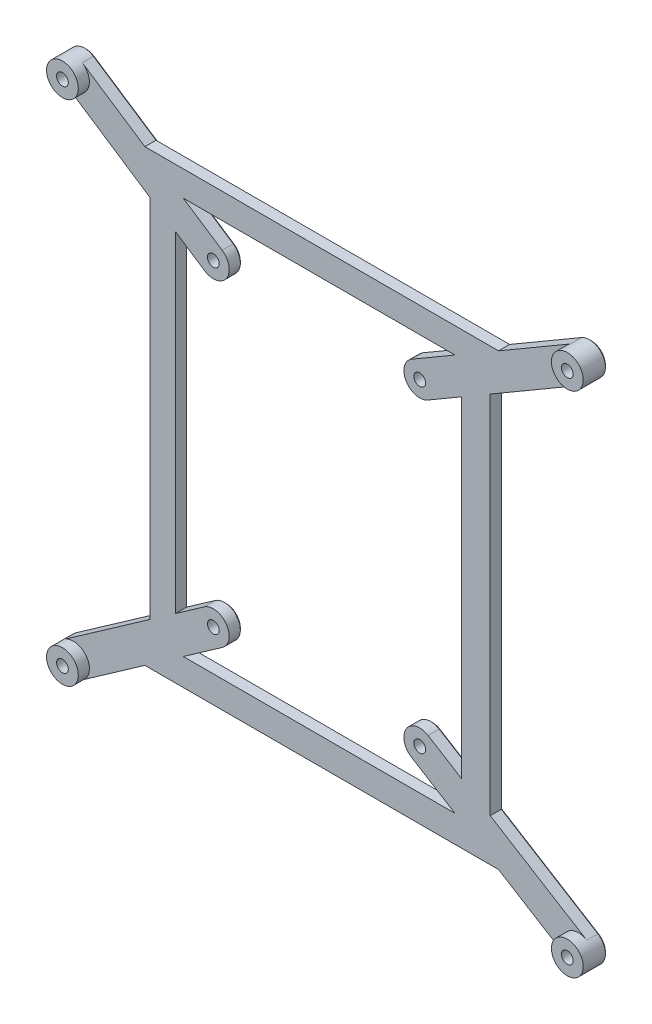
SolidWorks part; units mm, degrees
ref_plane "Ebene vorne" through (0, 0, 0) normal (0, 0, 1) x (1, 0, 0)
ref_plane "Ebene oben" through (0, 0, 0) normal (0, 1, 0) x (1, 0, 0)
ref_plane "Ebene rechts" through (0, 0, 0) normal (1, 0, 0) x (0, 0, -1)
sketch "Skizze1" plane through (0, 0, 0) normal (0, 0, 1) x (1, 0, 0)
  line L5 (82.1313, -75.7293) -> (51.7323, -56.9557)
  line L19 (32.1613, -44.8693) -> (26.8987, -53.3907) construction
  line L20 (-32.6003, -53.2245) -> (-38.3397, -45.0355) construction
  line L25 (-55.347, 58.0292) -> (-55.347, -56.9557)
  line L26 (-32.7105, 55.0396) -> (-38.2295, 46.7004) construction
  line L28 (-38.3397, -45.0355) -> (-47.347, -51.3486)
  line L29 (-76.6303, -84.0845) -> (-57.0231, -70.3421)
  line L31 (26.8987, -53.3907) -> (40.6285, -61.8699)
  line L32 (32.0488, 46.5508) -> (27.0112, 55.1892) construction
  line L33 (27.0112, 55.1892) -> (40.6285, 63.1301)
  line L35 (-76.7405, 84.1796) -> (-57.0231, 71.1301)
  line L36 (-38.2295, 46.7004) -> (-47.347, 52.7346)
  line L38 (82.0188, 75.6908) -> (51.7323, 58.0292)
  line L39 (-47.347, 52.7346) -> (-47.347, -51.3486)
  line L40 (-55.347, 58.0292) -> (-82.2595, 75.8404)
  line L41 (-55.347, -56.9557) -> (-82.3697, -75.8955)
  line L42 (-57.0231, 71.1301) -> (54.3471, 71.1301)
  line L43 (40.6285, 63.1301) -> (-44.9352, 63.1301)
  line L44 (42.653, -51.3486) -> (42.653, 52.7346)
  line L45 (51.7323, 58.0292) -> (51.7323, -56.9557)
  line L46 (-57.0231, -70.3421) -> (54.3471, -70.3421)
  line L47 (40.6285, -61.8699) -> (-44.9352, -61.8699)
  line L48 (-44.9352, -61.8699) -> (-32.6003, -53.2245)
  line L49 (54.3471, -70.3421) -> (76.8687, -84.2507)
  line L50 (42.653, -51.3486) -> (32.1613, -44.8693)
  line L51 (42.653, 52.7346) -> (32.0488, 46.5508)
  line L52 (54.3471, 71.1301) -> (76.9812, 84.3292)
  line L53 (-44.9352, 63.1301) -> (-32.7105, 55.0396)
  line L54 (-47.347, 0.693) -> (42.653, 0.693) construction
  line L55 (-2.1534, 63.1301) -> (-2.1534, -61.8699) construction
  arc A0 (-82.3697, -75.8955) -> (-76.6303, -84.0845) centre (-79.5, -79.99) ccw
  arc A1 (76.8687, -84.2507) -> (82.1313, -75.7293) centre (79.5, -79.99) ccw
  arc A2 (-32.6003, -53.2245) -> (-38.3397, -45.0355) centre (-35.47, -49.13) ccw
  arc A3 (26.8987, -53.3907) -> (32.1613, -44.8693) centre (29.53, -49.13) cw
  circle A4 centre (-35.47, -49.13) radius 1.85
  circle A5 centre (29.53, -49.13) radius 1.85
  circle A6 centre (29.53, 50.87) radius 1.85
  circle A7 centre (-35.47, 50.87) radius 1.85
  arc A8 (76.9812, 84.3292) -> (82.0188, 75.6908) centre (79.5, 80.01) cw
  arc A9 (-82.2595, 75.8404) -> (-76.7405, 84.1796) centre (-79.5, 80.01) cw
  circle A10 centre (-79.5, 80.01) radius 1.85
  circle A11 centre (79.5, 80.01) radius 1.85
  circle A12 centre (79.5, -79.99) radius 1.85
  circle A13 centre (-79.5, -79.99) radius 1.85
  arc A14 (27.0112, 55.1892) -> (32.0488, 46.5508) centre (29.53, 50.87) ccw
  arc A15 (-32.7105, 55.0396) -> (-38.2295, 46.7004) centre (-35.47, 50.87) cw
  point P1 (29.53, -49.13)
  point P5 (-35.47, -49.13)
extrude "Aufsatz-Linear austragen1" add sketch "Skizze1" against normal blind 4
sketch "Skizze5" plane through (0, 0, 0) normal (0, 0, 1) x (1, 0, 0)
  circle A0 centre (-79.5, -79.99) radius 5
  circle A1 centre (79.5, -79.99) radius 5.0078
  arc A2 (76.8687, -84.2507) -> (82.1313, -75.7293) centre (79.5, -79.99) ccw construction
  arc A3 (-82.3697, -75.8955) -> (-76.6303, -84.0845) centre (-79.5, -79.99) ccw construction
  circle A4 centre (-79.5, 80.01) radius 5
  circle A5 centre (79.5, 80.01) radius 5
  arc A6 (82.0188, 75.6908) -> (76.9812, 84.3292) centre (79.5, 80.01) ccw construction
  arc A7 (-76.7405, 84.1796) -> (-82.2595, 75.8404) centre (-79.5, 80.01) ccw construction
  circle A8 centre (-79.5, 80.01) radius 1.85
  circle A9 centre (79.5, 80.01) radius 1.85
  circle A10 centre (79.5, -79.99) radius 1.85
  circle A11 centre (-79.5, -79.99) radius 1.85
  circle A12 centre (-79.5, 80.01) radius 1.85 construction
  circle A13 centre (79.5, 80.01) radius 1.85 construction
  circle A14 centre (79.5, -79.99) radius 1.85 construction
  circle A15 centre (-79.5, -79.99) radius 1.85 construction
extrude "Aufsatz-Linear austragen2" add sketch "Skizze5" along normal blind 3.5
chamfer "Fase1" distance 0.5 angle 45 40 edges at (-55.347, 0.5367, -4) (-68.8584, -66.4256, -4) (-83.5945, -82.8597, -4) (-66.8267, -77.2133, -4) (-1.338, -70.3421, -4) (65.6079, -77.2964, -4) (83.7607, -82.6213, -4) (66.9318, -66.3425, -4) (51.7323, 0.5367, -4) (66.8755, 66.86, -4) (83.8192, 82.5288, -4) (65.6642, 77.7297, -4) (-1.338, 71.1301, -4) (-66.8818, 77.6548, -4) (-83.6696, 82.7695, -4) (-68.8033, 66.9348, -4) (-42.8434, -48.1921, -4) (-47.347, 0.693, -4) (-42.7883, 49.7175, -4) (-31.3004, 48.1105, -4) (-38.8229, 59.0848, -4) (-2.1534, 63.1301, -4) (33.8199, 59.1597, -4) (25.2108, 48.3512, -4) (37.3509, 49.6427, -4) (42.653, 0.693, -4) (37.4071, -48.1089, -4) (25.2693, -46.4987, -4) (33.7636, -57.6303, -4) (-2.1534, -61.8699, -4) (-38.7677, -57.5472, -4) (-31.3755, -46.2603, -4) (-33.62, -49.13, -4) (31.38, -49.13, -4) (81.35, 80.01, -4) (81.35, -79.99, -4) (-77.65, -79.99, -4) (27.68, 50.87, -4) (-37.32, 50.87, -4) (-77.65, 80.01, -4)
equation "\"D7@Skizze1\"=\"D6@Skizze1\""
equation "\"D3@Skizze1\"=\"D6@Skizze1\""
equation "\"D5@Skizze1\"=\"D4@Skizze1\""
